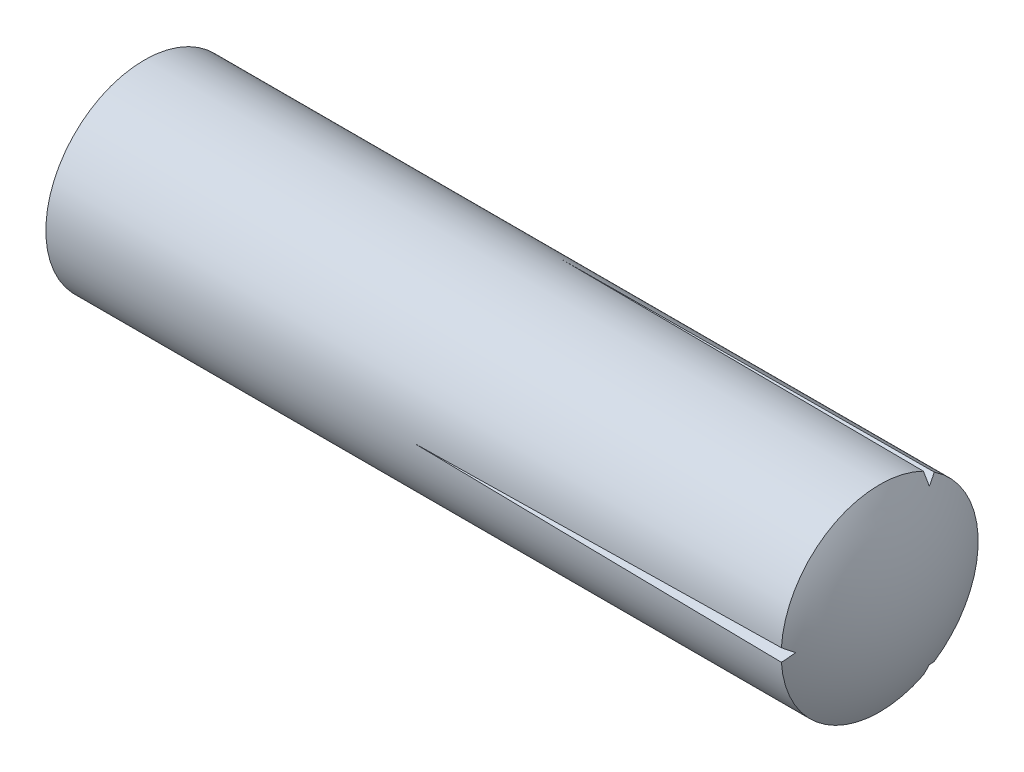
SolidWorks part; units mm, degrees
ref_plane "Plane1" through (0, 0, 0) normal (0, 0, 1) x (1, 0, 0)
ref_plane "Plane2" through (0, 0, 0) normal (0, 1, 0) x (1, 0, 0)
ref_plane "Plane3" through (0, 0, 0) normal (1, 0, 0) x (0, 0, -1)
sketch "Sketch1" plane through (0, 0, 0) normal (0, 0, 1) x (1, 0, 0)
  line L0 (-40, 0) -> (40, 0) construction
  line L1 (-100, 0) -> (-100, 1.25)
  line L2 (-96.6819, 12.5) -> (-3.3494, 12.5)
  line L4 (0, 0) -> (-100, 0)
  arc A0 (-96.6819, 12.5) -> (-100, 1.25) centre (-75.0313, 0) ccw
  arc A1 (0, 0) -> (-3.3494, 12.5) centre (-25, 0) ccw
  dimension "D2" = 25
  dimension "D1" = 25
  dimension "D3" = 2.5
  dimension "Diameter" = 25
  dimension "Length" = 100
revolve "Base-Revolve" add sketch "Sketch1" angle 360 about L0
sketch "Sketch2" plane through (0, 0, 0) normal (1, 0, 0) x (0, 0, -1)
  line L0 (0, 0) -> (-15, 0) construction
  line L1 (-11.25, 0) -> (-12.5, 0.8753)
  line L2 (-11.25, 0) -> (-12.5, -0.8753)
  line L3 (-12.5, -0.8753) -> (-12.5, 0.8753)
  circle A0 centre (0, 0) radius 11.25 construction
  circle A1 centre (0, 0) radius 12.5 construction
  dimension "D1" = 22.5
  dimension "D2" = 70
  dimension "D3" = 35
sketch "Sketch4" plane through (0, 0, 0) normal (0, 1, 0) x (1, 0, 0)
  line L0 (-110, 0) -> (10, 0) construction
  line L1 (-40, 0) -> (40, 0) construction
  line L2 (0, -11.25) -> (-50, -12.5)
  dimension "D1" = 22.5
  dimension "D2" = 50
  dimension "D3" = 25
sweep "Cut-Sweep1" cut profiles "Sketch2" path "Sketch4"
pattern_circular "CirPattern1" count 3 over 360 about axis through (0, 0, 0) along (1, 0, 0) of "Cut-Sweep1"
equation "\"D1@Sketch1\" = \"Diameter@Sketch1\""
equation "\"D2@Sketch1\" = \"Diameter@Sketch1\""
equation "\"D3@Sketch1\" = \"Diameter@Sketch1\" * .1"
equation "\"D1@Sketch2\" = \"Diameter@Sketch1\" * .9"
equation "\"D3@Sketch2\" = \"D2@Sketch2\" / 2"
equation "\"D1@Sketch4\" = \"D1@Sketch2\""
equation "\"D2@Sketch4\" = \"Length@Sketch1\" / 2"
equation "\"D3@Sketch4\" = \"Diameter@Sketch1\""
